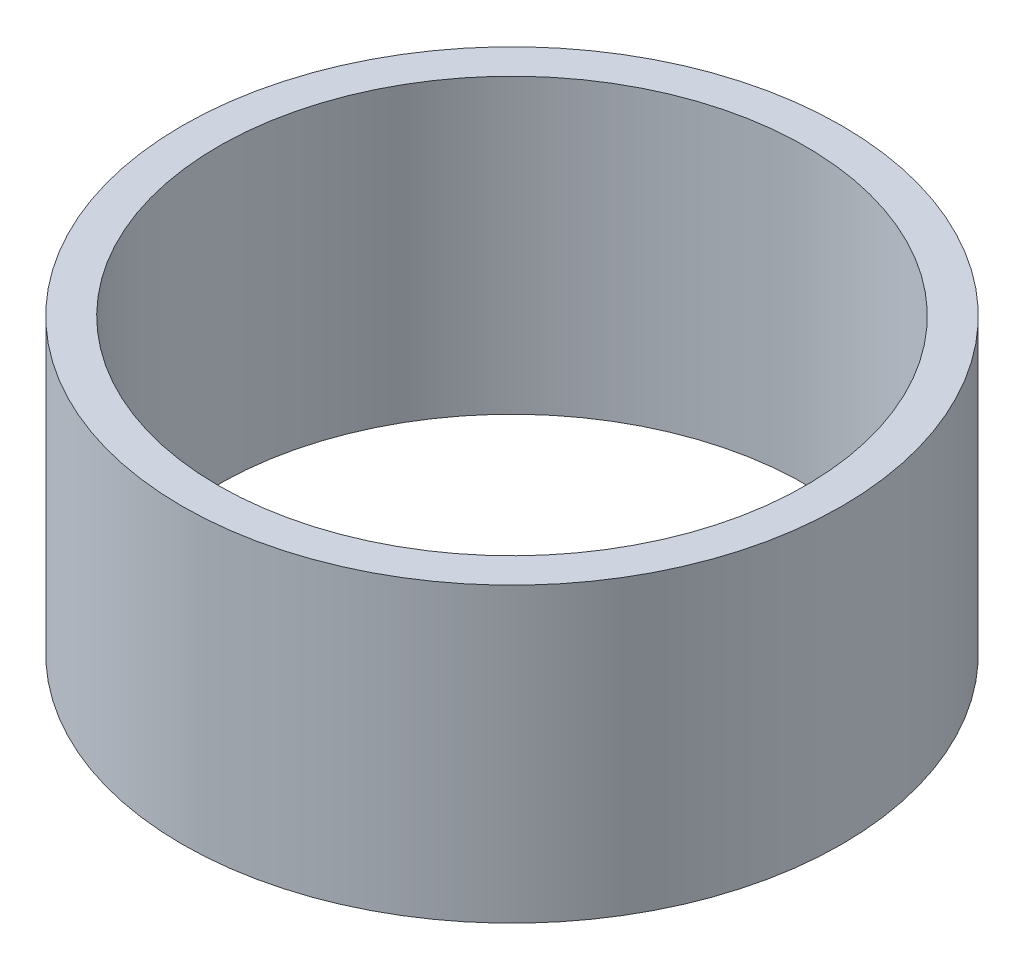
SolidWorks part; units mm, degrees
ref_plane "Front" through (0, 0, 0) normal (0, 0, 1) x (1, 0, 0)
ref_plane "Top" through (0, 0, 0) normal (0, 1, 0) x (1, 0, 0)
ref_plane "Right" through (0, 0, 0) normal (1, 0, 0) x (0, 0, -1)
sketch "Sketch1" plane through (0, 0, 0) normal (0, 1, 0) x (1, 0, 0)
  circle A0 centre (0, 0) radius 71.5158
extrude "Boss-Extrude1" add sketch "Sketch1" along normal blind 63.5
sketch "Sketch2" plane through (0, 63.5, 0) normal (0, 1, 0) x (1, 0, 0)
  circle A0 centre (0, 0) radius 63.7032
  dimension "D1" = 127.4064
extrude "Cut-Extrude1" cut sketch "Sketch2" against normal through all
